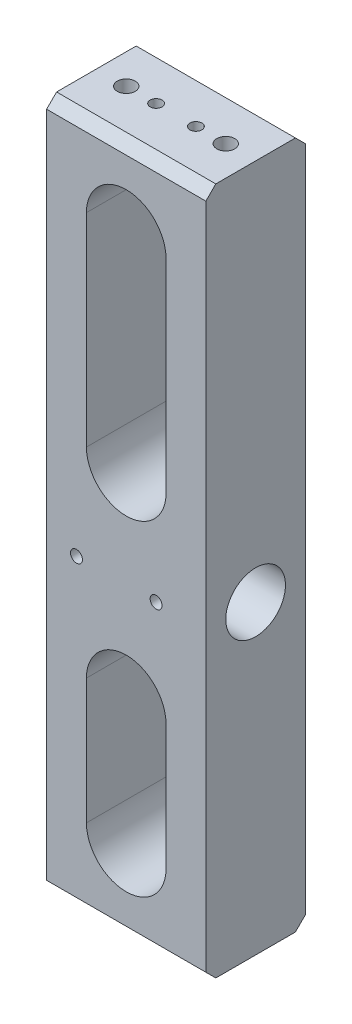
SolidWorks part; units mm, degrees
ref_plane "Plan de face" through (0, 0, 0) normal (0, 0, 1) x (1, 0, 0)
ref_plane "Plan de dessus" through (0, 0, 0) normal (0, 1, 0) x (1, 0, 0)
ref_plane "Plan de droite" through (0, 0, 0) normal (1, 0, 0) x (0, 0, -1)
sketch "Esquisse1" plane through (0, 0, 0) normal (0, 0, 1) x (1, 0, 0)
  line L0 (-20, 152) -> (-20, 50)
  line L1 (-40, 192) -> (40, 192)
  line L2 (-40, 192) -> (-40, -153.5)
  line L3 (-40, -153.5) -> (40, -153.5)
  line L4 (40, 192) -> (40, -153.5)
  line L5 (20, 152) -> (20, 50)
  line L6 (-20, -50.5) -> (-20, -113.5)
  line L7 (20, -50.5) -> (20, -113.5)
  arc A0 (20, 152) -> (-20, 152) centre (0, 152) ccw
  arc A1 (-20, 50) -> (20, 50) centre (0, 50) ccw
  arc A2 (20, -50.5) -> (-20, -50.5) centre (0, -50.5) ccw
  arc A3 (-20, -113.5) -> (20, -113.5) centre (0, -113.5) ccw
  point P4 (0, 192)
  dimension "D4" = 40
  dimension "D1" = 345.5
  dimension "D2" = 192
  dimension "D3" = 80
  dimension "D5" = 102
  dimension "D6" = 40
  dimension "D7" = 63
  dimension "D8" = 40
extrude "Boss.-Extru.1" add sketch "Esquisse1" along normal mid plane 50
chamfer "Chanfrein1" distance 5 angle 45 8 edges at (-40, -153.5, 0) (40, -153.5, 0) (-40, 192, 0) (40, 192, 0) (0, 192, 25) (0, 192, -25) (0, -153.5, 25) (0, -153.5, -25)
sketch "Esquisse2" plane through (-40, 0, 0) normal (-1, 0, 0) x (0, 0, 1)
  circle A0 centre (0, 0) radius 15
  dimension "D1" = 30
extrude "Enlèv. mat.-Extru.1" cut sketch "Esquisse2" against normal up to surface (80 mm away)
sketch "Esquisse3" plane through (0, 0, -25) normal (0, 0, -1) x (-1, 0, 0)
  line L0 (40, 187) -> (40, -148.5) construction
  circle A0 centre (25, 0) radius 3
  circle A1 centre (-15, 0) radius 3
  dimension "D1" = 6
  dimension "D2" = 40
  dimension "D3" = 15
extrude "Enlèv. mat.-Extru.2" cut sketch "Esquisse3" against normal through all
hole_wizard "Trou taraudé M10x1.01" positions "Esquisse7" profile "Esquisse6" tap size "M10x1.0" standard "Iso"
sketch "Esquisse7" plane through (0, 192, 0) normal (0, 1, 0) x (1, 0, 0)
  line L2 (-40, 25) -> (40, 25) construction
  line L3 (-40, -20) -> (-40, 20) construction
  point P0 (25, 0)
  point P2 (-25, 0)
  dimension "D1" = 50
  dimension "D2" = 25
  dimension "D3" = 15
sketch "Esquisse6" plane through (25, 192, 0) normal (1, 0, 0) x (0, 0, 1)
  line L0 (0, 0) -> (0, 30.7039)
  line L1 (0, 30.7039) -> (4.5, 28)
  line L2 (4.5, 28) -> (4.5, 0)
  line L5 (4.5, 0) -> (0, 0)
  line L10 (0, 30.7039) -> (-4.5, 28) construction
  line L11 (0, -6.35) -> (0, 107.95) construction
  dimension "Diamètre du trou pour taraudage" = 9
  dimension "Profondeur du trou pour taraudage" = 28
  dimension "Angle de pointe" = 118
hole_wizard "Diamètre du perçage Ø6.0 (6)1" positions "Esquisse9" profile "Esquisse8" hole size "Ø6.0" standard "Iso"
sketch "Esquisse9" plane through (0, 192, 0) normal (0, 1, 0) x (1, 0, 0)
  line L2 (-40, -20) -> (-40, 20) construction
  line L3 (-40, 25) -> (40, 25) construction
  point P0 (-10, 0)
  point P2 (10, 0)
  dimension "D1" = 20
  dimension "D2" = 30
  dimension "D3" = 25
sketch "Esquisse8" plane through (-10, 192, 0) normal (1, 0, 0) x (0, 0, 1)
  line L0 (0, 0) -> (0, 7.8026)
  line L1 (0, 7.8026) -> (3, 6)
  line L2 (3, 6) -> (3, 0)
  line L5 (3, 0) -> (0, 0)
  line L10 (0, 7.8026) -> (-3, 6) construction
  line L11 (0, -6.35) -> (0, 107.95) construction
  dimension "Diamètre du perçage" = 6
  dimension "Profondeur du perçage" = 6
  dimension "Angle de pointe" = 118
hole_wizard "Trou taraudé M121" positions "Esquisse12" profile "Esquisse11" tap size "M12" standard "Iso"
sketch "Esquisse12" plane through (0, -153.5, 0) normal (0, -1, 0) x (-1, 0, 0)
  line L3 (40, -25) -> (-40, -25) construction
  line L4 (-40, -20) -> (-40, 20) construction
  point P0 (-28, 0)
  dimension "D1" = 12
  dimension "D2" = 25
sketch "Esquisse11" plane through (28, -153.5, 0) normal (1, 0, 0) x (0, 0, -1)
  line L0 (0, 0) -> (0, 43.0644)
  line L1 (0, 43.0644) -> (5.1, 40)
  line L2 (5.1, 40) -> (5.1, 0)
  line L5 (5.1, 0) -> (0, 0)
  line L10 (0, 43.0644) -> (-5.1, 40) construction
  line L11 (0, -6.35) -> (0, 107.95) construction
  dimension "Diamètre du trou pour taraudage" = 10.2
  dimension "Profondeur du trou pour taraudage" = 40
  dimension "Angle de pointe" = 118
hole_wizard "Diamètre du perçage Ø12.5 (12.5)1" positions "Esquisse14" profile "Esquisse13" hole size "Ø12.5" standard "Iso"
sketch "Esquisse14" plane through (0, -153.5, 0) normal (0, -1, 0) x (-1, 0, 0)
  point P0 (-28, 0)
sketch "Esquisse13" plane through (28, -153.5, 0) normal (1, 0, 0) x (0, 0, -1)
  line L0 (0, 0) -> (0, 13.7554)
  line L1 (0, 13.7554) -> (6.25, 10)
  line L2 (6.25, 10) -> (6.25, 0)
  line L5 (6.25, 0) -> (0, 0)
  line L10 (0, 13.7554) -> (-6.25, 10) construction
  line L11 (0, -6.35) -> (0, 107.95) construction
  dimension "Diamètre du perçage" = 12.5
  dimension "Profondeur du perçage" = 10
  dimension "Angle de pointe" = 118
hole_wizard "Diamètre du perçage Ø11.0 (11)1" positions "Esquisse16" profile "Esquisse15" hole size "Ø11.0" standard "Iso"
sketch "Esquisse16" plane through (0, -153.5, 0) normal (0, -1, 0) x (-1, 0, 0)
  line L0 (-40, 0) -> (40, 0) construction
  line L3 (-40, -20) -> (-40, 20) construction
  point P0 (33, 0)
  dimension "D1" = 73
sketch "Esquisse15" plane through (-33, -153.5, 0) normal (1, 0, 0) x (0, 0, -1)
  line L0 (0, 0) -> (0, 11.3047)
  line L1 (0, 11.3047) -> (5.5, 8)
  line L2 (5.5, 8) -> (5.5, 0)
  line L5 (5.5, 0) -> (0, 0)
  line L10 (0, 11.3047) -> (-5.5, 8) construction
  line L11 (0, -6.35) -> (0, 107.95) construction
  dimension "Diamètre du perçage" = 11
  dimension "Profondeur du perçage" = 8
  dimension "Angle de pointe" = 118
